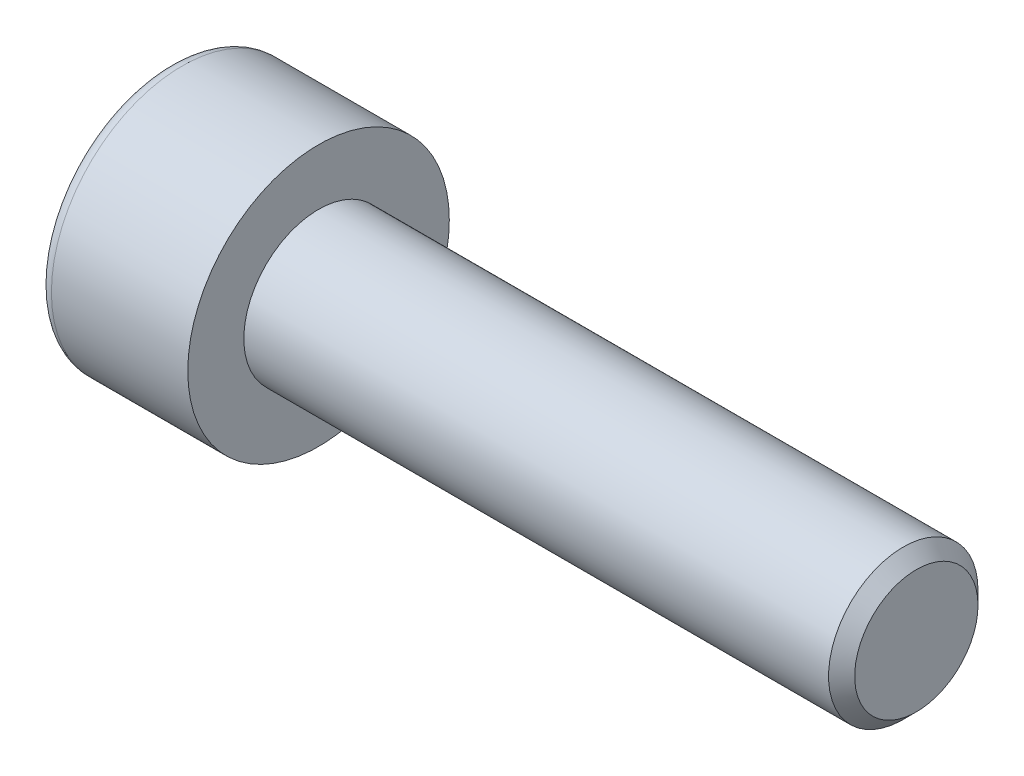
SolidWorks part; units mm, degrees
ref_plane "Plan1" through (0, 0, 0) normal (0, 0, 1) x (1, 0, 0)
ref_plane "Plan2" through (0, 0, 0) normal (0, 1, 0) x (1, 0, 0)
ref_plane "Plan3" through (0, 0, 0) normal (1, 0, 0) x (0, 0, -1)
sketch "Esquisse1" plane through (0, 0, 0) normal (0, 0, 1) x (1, 0, 0)
  line L0 (12.5013, 0) -> (-4.9882, 0) construction
  line L1 (0, 2) -> (0, 3.5)
  line L2 (0, 2) -> (16, 2)
  line L3 (16, 2) -> (16, 0)
  line L4 (0, 3.5) -> (-4, 3.5)
  line L5 (-4, 3.5) -> (-4, 0)
  line L6 (16, 0) -> (-4, 0)
  dimension "Ø tige" = 4
  dimension "Ø tete" = 7
  dimension "longueur tige" = 16
  dimension "hauteur tete" = 4
revolve "Base-Révolution" add sketch "Esquisse1" angle 360 about L0
chamfer "Chanfrein tige" distance 0.35 angle 45 1 edges at (16, 0, -2)
fillet "Congé tete" radius 0.35 1 edges at (-4, 0, -3.5)
sketch "Esquisse2" plane through (-4, 0, 0) normal (-1, 0, 0) x (0, 0, 1)
  line L1 (1.7321, 0) -> (0.866, 1.5)
  line L2 (0.866, 1.5) -> (-0.866, 1.5)
  line L3 (-0.866, 1.5) -> (-1.7321, 0)
  line L4 (-1.7321, 0) -> (-0.866, -1.5)
  line L5 (-0.866, -1.5) -> (0.866, -1.5)
  line L6 (0.866, -1.5) -> (1.7321, 0)
  circle A0 centre (0, 0) radius 1.5 construction
  dimension "largeur creux" = 3
extrude "Enlèv. mat.-Extru.1" cut sketch "Esquisse2" against normal blind 2.4
